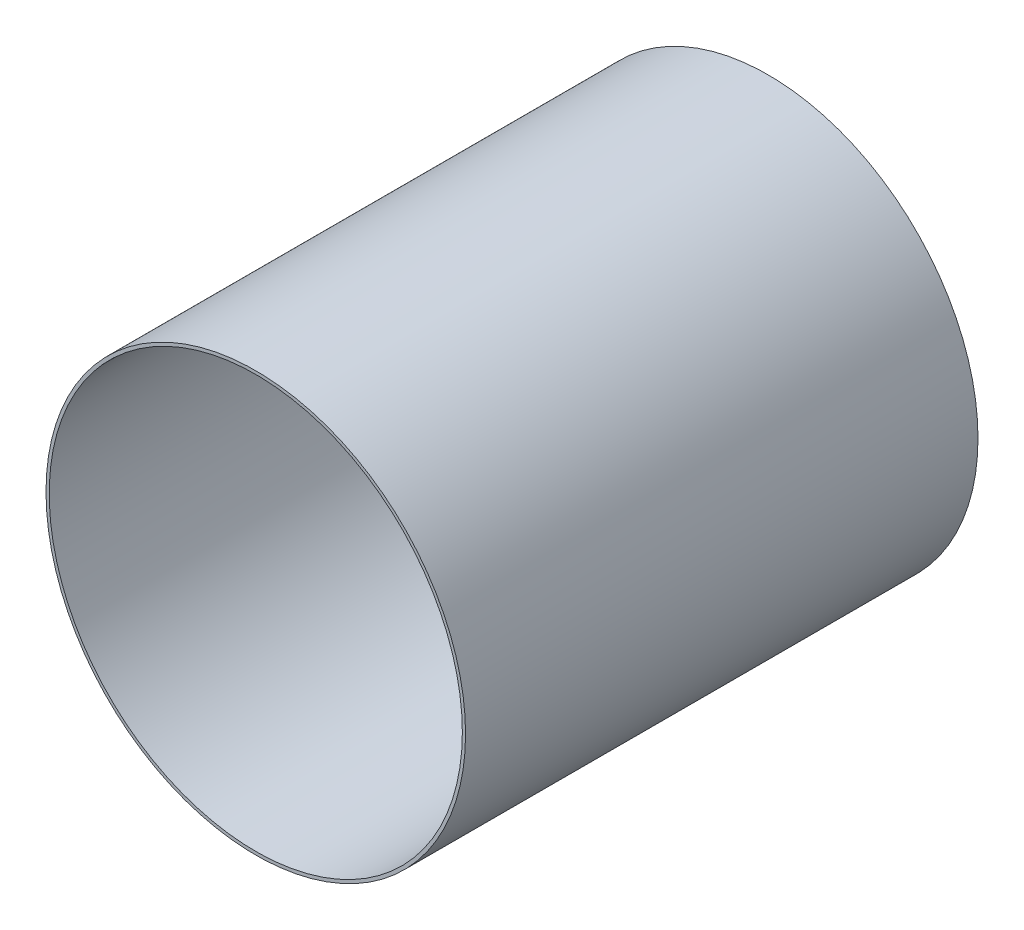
SolidWorks part; units mm, degrees
ref_plane "Plano frontal" through (0, 0, 0) normal (0, 0, 1) x (1, 0, 0)
ref_plane "Plano superior" through (0, 0, 0) normal (0, 1, 0) x (1, 0, 0)
ref_plane "Plano direito" through (0, 0, 0) normal (1, 0, 0) x (0, 0, -1)
sketch "Esboço1" plane through (0, 0, 0) normal (0, 0, 1) x (1, 0, 0)
  circle A0 centre (0, 0) radius 13.1
  circle A1 centre (0, 0) radius 12.9
extrude "Ressalto-extrusão2" add sketch "Esboço1" along normal blind 31
sketch "Esboço2" plane through (0, 0, 0) normal (0, 0, -1) x (-1, 0, 0)
  circle A0 centre (0, 0) radius 13.1
extrude "Ressalto-extrusão3" add sketch "Esboço2" along normal blind 1
